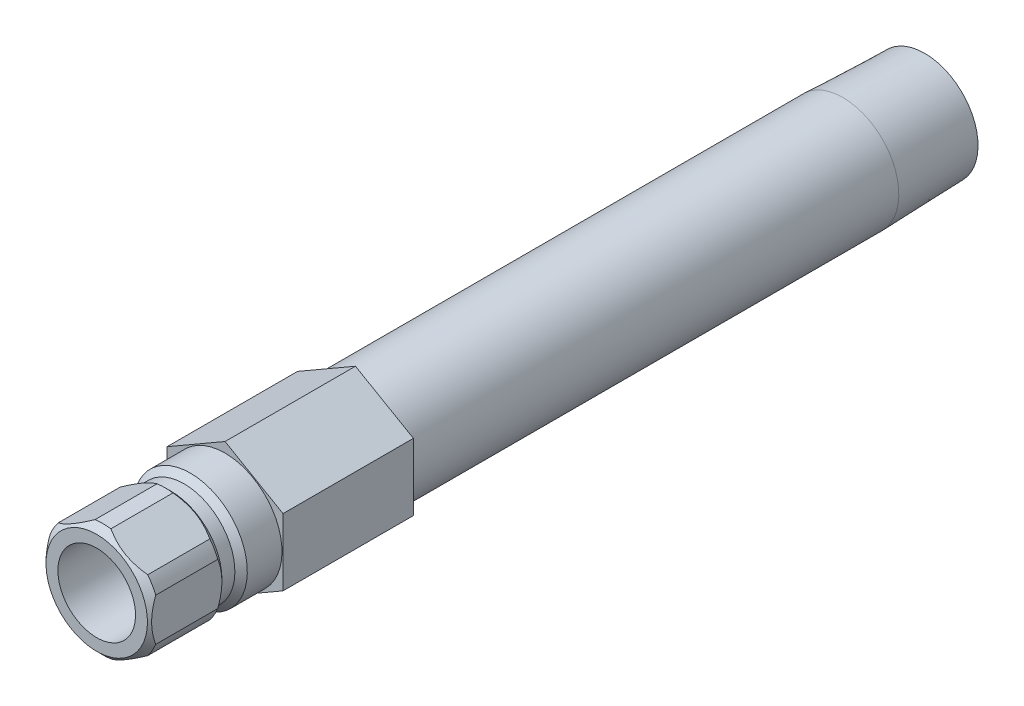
SolidWorks part; units mm, degrees
ref_plane "Front Plane" through (0, 0, 0) normal (0, 0, 1) x (1, 0, 0)
ref_plane "Top Plane" through (0, 0, 0) normal (0, 1, 0) x (1, 0, 0)
ref_plane "Right Plane" through (0, 0, 0) normal (1, 0, 0) x (0, 0, -1)
sketch "Sketch1" plane through (0, 0, 0) normal (1, 0, 0) x (0, 0, -1)
  line L0 (-12.8748, 0) -> (-18.923, 0) construction
  line L1 (-15.748, 4.7625) -> (-15.748, 6.223)
  line L2 (-6.604, 6.223) -> (-6.604, 0) construction
  line L3 (-14.986, 6.985) -> (-7.366, 6.985)
  line L4 (-3.556, 4.7625) -> (-3.556, 6.858) construction
  line L5 (-6.604, 6.223) -> (-5.0165, 6.223)
  line L6 (-4.2545, 6.985) -> (0, 6.985)
  line L7 (0, 6.985) -> (0, 6.858)
  line L8 (-6.604, 6.223) -> (-7.366, 6.985)
  line L9 (-5.0165, 6.223) -> (-4.2545, 6.985)
  line L10 (-15.748, 6.223) -> (-14.986, 6.985)
  line L11 (-15.748, 4.7625) -> (-3.556, 4.7625)
  line L12 (0, 6.858) -> (75.819, 6.858)
  line L13 (75.819, 6.858) -> (85.852, 6.5445)
  line L14 (85.852, 6.5445) -> (85.852, 4.6228)
  line L15 (-3.556, 4.7625) -> (-3.4817, 4.6228)
  line L16 (16.002, 6.858) -> (16.002, 0) construction
  line L17 (16.002, 0) -> (-12.8748, 0) construction
  line L19 (-3.4817, 4.6228) -> (85.852, 4.6228)
  dimension "D1" = 15.748
  dimension "D2" = 1.5875
  dimension "D3" = 0.762
  dimension "D4" = 45
  dimension "D5" = 9.144
  dimension "D6" = 45
  dimension "D7" = 1.79
  dimension "D8" = 10.033
  dimension "D9" = 101.6
  dimension "D10" = 3.175
  dimension "D11" = 9.525
  dimension "D12" = 13.716
  dimension "D13" = 31.75
  dimension "D14" = 13.97
  dimension "D15" = 9.2456
  dimension "D17" = 118
  dimension "D18" = 12.192
revolve "Revolve1" add sketch "Sketch1" angle 360 about L0
sketch "Sketch2" plane through (0, 0, 0) normal (0, 0, 1) x (1, 0, 0)
  line L1 (-7.112, 4.1061) -> (-7.112, -4.1061)
  line L2 (-7.112, -4.1061) -> (0, -8.2122)
  line L3 (0, -8.2122) -> (7.112, -4.1061)
  line L4 (7.112, -4.1061) -> (7.112, 4.1061)
  line L5 (7.112, 4.1061) -> (0, 8.2122)
  line L6 (0, 8.2122) -> (-7.112, 4.1061)
  circle A0 centre (0, 0) radius 7.112 construction
  circle A1 centre (0, 0) radius 4.6228 construction
  circle A2 centre (0, 0) radius 4.6228
  dimension "D1" = 14.224
extrude "Boss-Extrude1" add sketch "Sketch2" against normal up to vertex (16.002 mm away)
sketch "Sketch3" plane through (0, 0, 0) normal (0, 0, 1) x (1, 0, 0)
  line L1 (6.477, -3.7395) -> (6.477, 3.7395)
  line L2 (6.477, 3.7395) -> (0, 7.479)
  line L3 (0, 7.479) -> (-6.477, 3.7395)
  line L4 (-6.477, 3.7395) -> (-6.477, -3.7395)
  line L5 (-6.477, -3.7395) -> (0, -7.479)
  line L6 (0, -7.479) -> (6.477, -3.7395)
  circle A0 centre (0, 0) radius 6.477 construction
  dimension "D1" = 12.954
extrude "Cut-Extrude1" cut sketch "Sketch3" along normal through all from vertex at 6.604 flip side to cut
